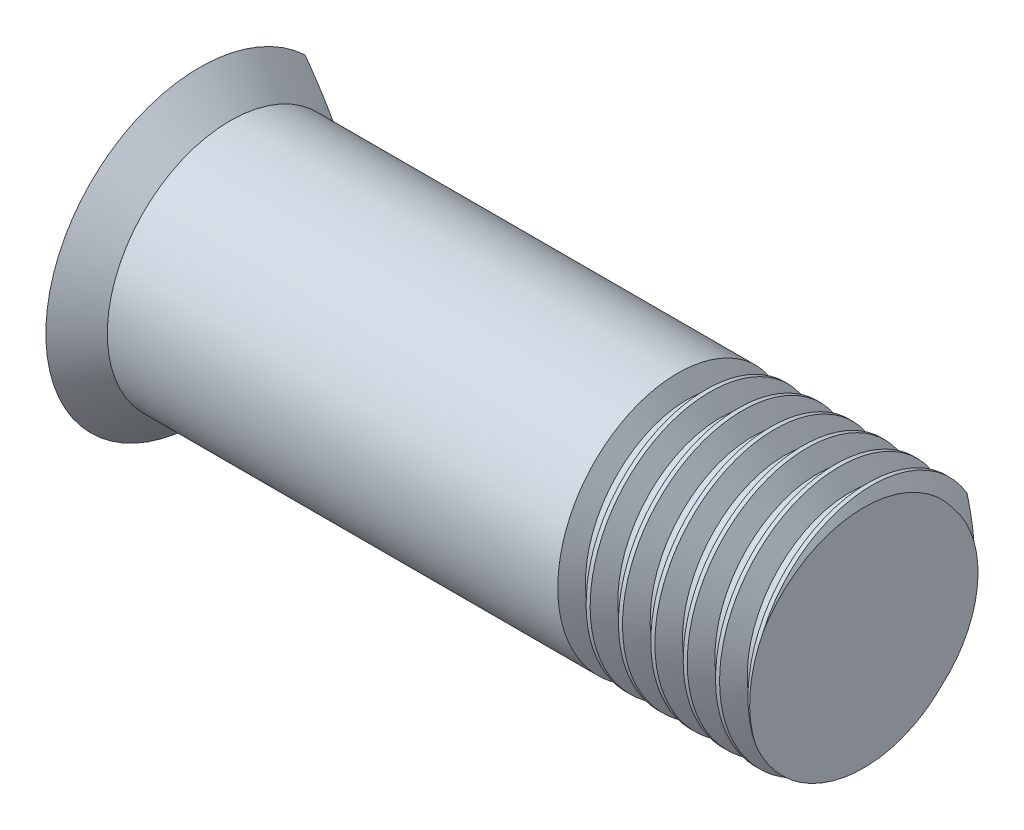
SolidWorks part; units mm, degrees
ref_plane "Front Plane" through (0, 0, 0) normal (0, 0, 1) x (1, 0, 0)
ref_plane "Top Plane" through (0, 0, 0) normal (0, 1, 0) x (1, 0, 0)
ref_plane "Right Plane" through (0, 0, 0) normal (1, 0, 0) x (0, 0, -1)
sketch "Sketch1" plane through (0, 0, 0) normal (0, 1, 0) x (1, 0, 0)
  circle A0 centre (0, 0) radius 4.826
  dimension "D1" = 9.652
extrude "Boss-Extrude1" add sketch "Sketch1" along normal blind 26.416 contours A0
thread "Thread1" pitch 1.27 start angle 0, offset 1.524, length 8.89, pitch 1.27, diameter 9.652
ref_plane "Plane1" through (4.826, -1.524, 0) normal (0, 0, 1) x (1, 0, 0)
sketch "Thread Profile1" plane through (4.826, -1.524, 0) normal (0, 0, 1) x (1, 0, 0)
  line L0 (0, 0) -> (0, 1.27) construction
  line L11 (0, 0) -> (0, 1.1112)
  line L12 (0, 1.1112) -> (-0.6874, 0.7144)
  line L13 (-0.6874, 0.7144) -> (-0.6874, 0.3969)
  line L15 (-0.6874, 0.3969) -> (0, 0)
  line L17 (-0.6874, 0.5556) -> (0, 0.5556) construction
  point P2 (0, 0)
  dimension "Pitch" = 1.27
  dimension "Profile_Angle" = 60
  dimension "Profile_Land" = 0.3175
  dimension "Profile_Height" = 0.6874
sketch "Sketch4" plane through (0, 26.416, 0) normal (0, 1, 0) x (1, 0, 0)
  circle A0 centre (0, 0) radius 6.0325
  dimension "D1" = 12.065
extrude "Boss-Extrude2" add sketch "Sketch4" against normal blind 1.2065
chamfer "Chamfer1" distance 1.2065 angle 45 1 edges at (0, 25.2095, 6.0325)
sketch "Sketch8" plane through (0, 0, 0) normal (0, -1, 0) x (1, 0, 0)
  line L0 (0, 0) -> (0, 4.1386) construction
  line L1 (6.35, 4.1386) -> (-6.35, 4.1386)
  arc A0 (3.1551, 2.6783) -> (-2.6783, 3.1551) centre (0, 0) ccw construction
  arc A1 (6.35, 4.1386) -> (-6.35, 4.1386) centre (0, 2.0693) ccw
  point P2 (0, 4.1386)
  point P8 (0, 4.1386)
  point P10 (0, 2.0693)
  dimension "D2" = 12.7
extrude "Cut-Extrude1" cut sketch "Sketch8" against normal up to surface (26.416 mm away)
sketch "Sketch9" plane through (0, 26.416, 0) normal (0, 1, 0) x (1, 0, 0)
  line L0 (0, -2.032) -> (0, 2.032) construction
  line L5 (-0.508, -2.032) -> (-0.508, 2.032)
  line L6 (0.508, -2.032) -> (0.508, 2.032)
  arc A0 (-0.508, -2.032) -> (0.508, -2.032) centre (0, -2.032) ccw
  arc A1 (0.508, 2.032) -> (-0.508, 2.032) centre (0, 2.032) ccw
  point P2 (0, 0)
  dimension "D1" = 4.064
  dimension "D2" = 1.016
extrude "Cut-Extrude2" cut sketch "Sketch9" against normal blind 3.81
move or copy body "Body-Move/Copy1" bodies to move or copy 109 copy no rotation origin (6.4781, 6.4781, -0.6118) rotation axis (-0.7071, 0.7071, 0) rotation angle 180
